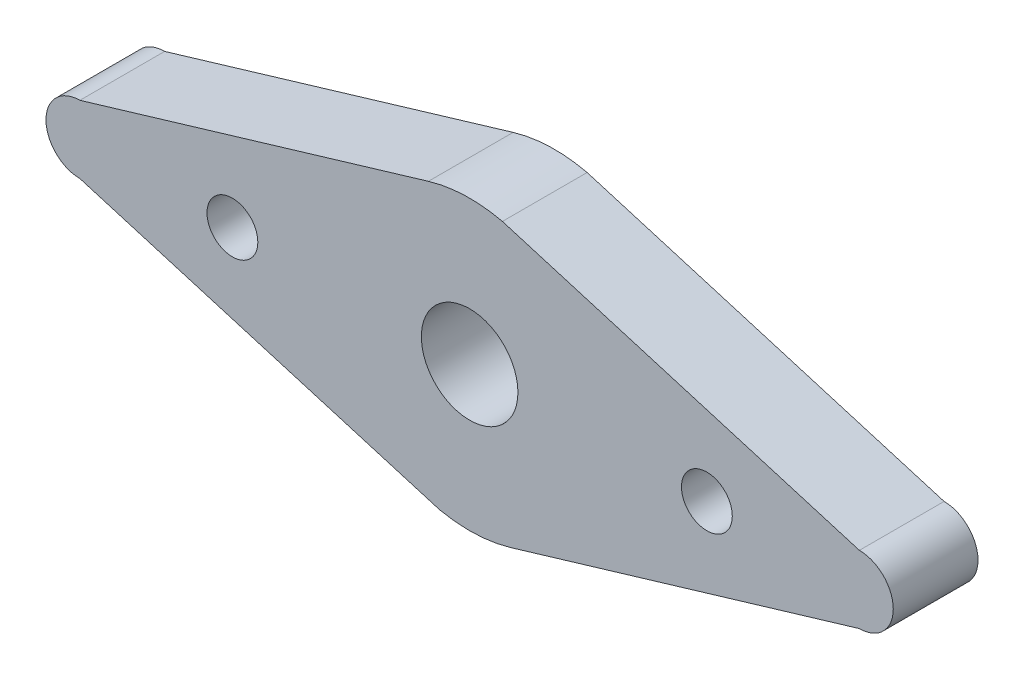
SolidWorks part; units mm, degrees
ref_plane "Front Plane" through (0, 0, 0) normal (0, 0, 1) x (1, 0, 0)
ref_plane "Top Plane" through (0, 0, 0) normal (0, 1, 0) x (1, 0, 0)
ref_plane "Right Plane" through (0, 0, 0) normal (1, 0, 0) x (0, 0, -1)
sketch "Sketch1" plane through (0, 0, 0) normal (0, 0, 1) x (1, 0, 0)
  line L4 (-23, 2) -> (-2.4331, 8.1443)
  line L5 (-23, -2) -> (-1.7619, -8.3154)
  line L6 (23, 2) -> (1.9332, 8.2772)
  line L7 (23, -2) -> (2.4331, -8.1443)
  arc A0 (2.9125, 7.9854) -> (-2.4331, 8.1443) centre (0, 0) ccw
  arc A1 (23, -2) -> (23, 2) centre (23, 0) ccw
  arc A2 (-23, 2) -> (-23, -2) centre (-23, 0) ccw
  arc A3 (-3.068, -7.927) -> (2.4331, -8.1443) centre (0, 0) ccw
  circle A4 centre (0, 0) radius 2.85
  circle A5 centre (-14, 0) radius 1.5
  circle A6 centre (14, 0) radius 1.5
  dimension "D1" = 17
  dimension "D2" = 5.7
  dimension "D3" = 3
extrude "Boss-Extrude1" add sketch "Sketch1" along normal blind 5 contours L5 A3 L7 A1 L6 A0 L4 A2 A6 A5 A4
